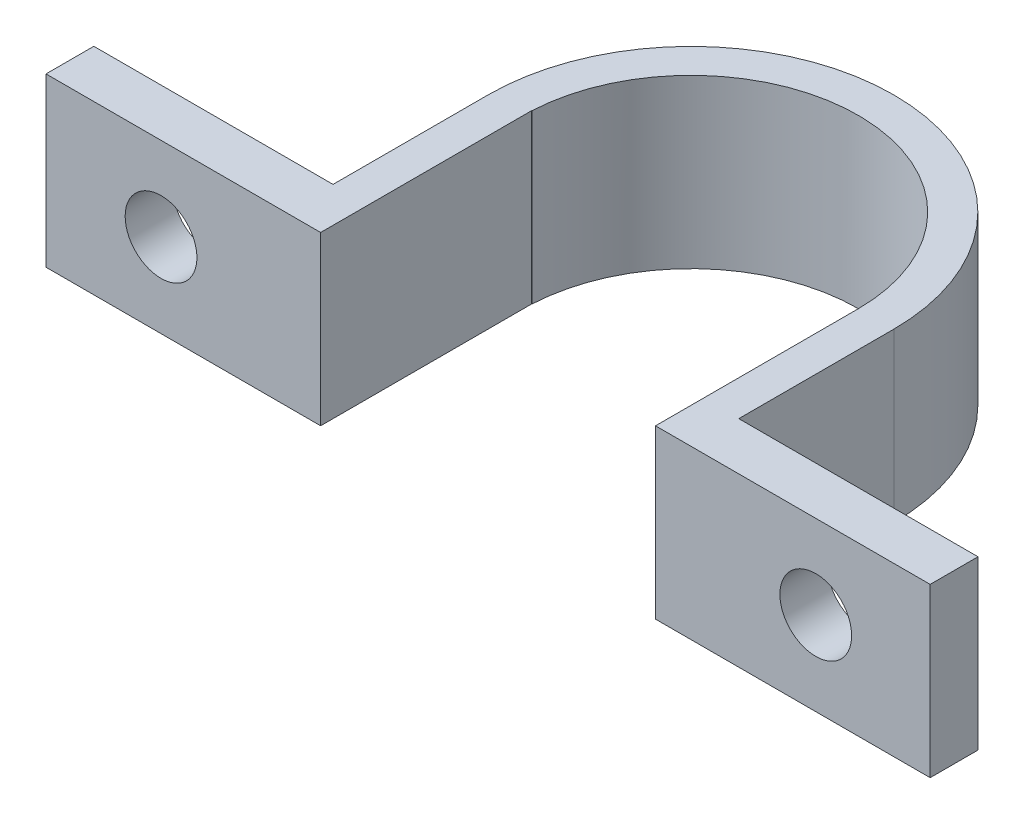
SolidWorks part; units mm, degrees
ref_plane "前视基准面" through (0, 0, 0) normal (0, 0, 1) x (1, 0, 0)
ref_plane "上视基准面" through (0, 0, 0) normal (0, 1, 0) x (1, 0, 0)
ref_plane "右视基准面" through (0, 0, 0) normal (1, 0, 0) x (0, 0, -1)
other "Configuration Table"
sketch "草图1" plane through (0, 0, 0) normal (0, 1, 0) x (1, 0, 0)
  line L0 (8.4815, 0) -> (8.4815, -8.4815)
  line L1 (8.4815, -8.4815) -> (18.4815, -8.4815)
  line L2 (18.4815, -8.4815) -> (18.4815, -10.4815)
  line L3 (-8.4815, 0) -> (-8.4815, -8.4815)
  line L4 (-8.4815, -8.4815) -> (-18.4815, -8.4815)
  line L5 (-18.4815, -8.4815) -> (-18.4815, -10.4815)
  line L6 (-18.4815, -10.4815) -> (18.9411, -10.4815)
  arc A3 (-8.4815, 0) -> (8.4815, 0) centre (0, 0) cw
  dimension "D1" = 10
  dimension "D2" = 2
  dimension "D3" = 10
extrude "凸台-拉伸1" add sketch "草图1" along normal blind 7 contours A3 L3 L4 L5 L6 L2 L1 L0
sketch "草图2" plane through (0, 7, 0) normal (0, 1, 0) x (1, 0, 0)
  circle A0 centre (0, 0) radius 7
extrude "切除-拉伸1" cut sketch "草图2" against normal blind 3
sketch "草图3" plane through (0, 7, 0) normal (0, 1, 0) x (1, 0, 0)
  line L0 (-7, 0) -> (-7, -10.4815)
  line L1 (-18.4815, -10.4815) -> (18.4815, -10.4815) construction
  line L2 (-7, -10.4815) -> (7, -10.4815)
  line L3 (7, -10.4815) -> (7, 0)
  line L4 (-7, 0) -> (7, 0)
  circle A0 centre (0, 0) radius 7 construction
extrude "切除-拉伸3" cut sketch "草图3" against normal blind 3
sketch "草图4" plane through (0, 7, 0) normal (0, 1, 0) x (1, 0, 0)
  line L1 (-7, -10.4815) -> (6.9917, -10.4815)
  line L2 (-7, -10.4815) -> (-7, 0.3402)
  line L3 (-7, 0.3402) -> (6.9917, 0.3402)
  line L4 (6.9917, -10.4815) -> (6.9917, 0.3402)
  circle A0 centre (0, 0) radius 7
extrude "切除-拉伸4" cut sketch "草图4" against normal blind 16 contours L3 L4 L1 L2 | A0
sketch "草图5" plane through (0, 0, 8.4815) normal (0, 0, -1) x (-1, 0, 0)
  circle A0 centre (13.6725, 3.5) radius 1.5
  circle A1 centre (-13.6994, 3.5) radius 1.5
extrude "切除-拉伸5" cut sketch "草图5" against normal blind 16
sketch "草图6" plane through (0, 7, 0) normal (0, 1, 0) x (1, 0, 0)
  line L0 (-8.4815, 0) -> (-8.4815, -8.4815) construction
  line L1 (-18.4815, -8.4815) -> (-8.4815, -8.4815)
  line L2 (-18.4815, -8.4815) -> (-18.4815, -6.4815)
  line L3 (-18.4815, -6.4815) -> (-8.4815, -6.4815)
  line L4 (-8.4815, -8.4815) -> (-8.4815, -6.4815)
  line L6 (8.4815, -8.4815) -> (18.4815, -8.4815)
  line L7 (8.4815, -8.4815) -> (8.4815, -6.4815)
  line L8 (8.4815, -6.4815) -> (18.4815, -6.4815)
  line L9 (18.4815, -8.4815) -> (18.4815, -6.4815)
  dimension "D1" = 2
extrude "凸台-拉伸2" add sketch "草图6" against normal blind 7
sketch "草图7" plane through (0, 0, 10.4815) normal (0, 0, 1) x (1, 0, 0)
  circle A0 centre (-13.6725, 3.5) radius 1.5
  circle A1 centre (13.6994, 3.5) radius 1.5
extrude "切除-拉伸6" cut sketch "草图7" against normal blind 7
sketch "草图8" plane through (0, 7, 0) normal (0, 1, 0) x (1, 0, 0)
  line L0 (-18.4815, -6.4815) -> (-18.4815, -10.4815) construction
  line L1 (-7, -10.4815) -> (-18.4815, -10.4815)
  line L2 (-7, -10.4815) -> (-7, -8.4815)
  line L3 (-7, -8.4815) -> (-18.4815, -8.4815)
  line L4 (-18.4815, -10.4815) -> (-18.4815, -8.4815)
  line L5 (18.4815, -6.4815) -> (18.4815, -10.4815) construction
  line L6 (7, -10.4815) -> (18.4815, -10.4815)
  line L7 (7, -10.4815) -> (7, -8.4815)
  line L8 (7, -8.4815) -> (18.4815, -8.4815)
  line L9 (18.4815, -10.4815) -> (18.4815, -8.4815)
extrude "切除-拉伸7" cut sketch "草图8" against normal blind 10
sketch "草图9" plane through (0, 0, 8.4815) normal (0, 0, 1) x (1, 0, 0)
  line L0 (18.4815, 7) -> (7, 7) construction
  line L1 (11.7525, 7) -> (5.8762, 7)
  line L2 (11.7525, 7) -> (11.7525, 0)
  line L3 (11.7525, 0) -> (5.8762, 0)
  line L4 (5.8762, 7) -> (5.8762, 0)
  line L5 (-6.9917, 0) -> (7, 0) construction
extrude "切除-拉伸8" cut sketch "草图9" along normal blind 3
